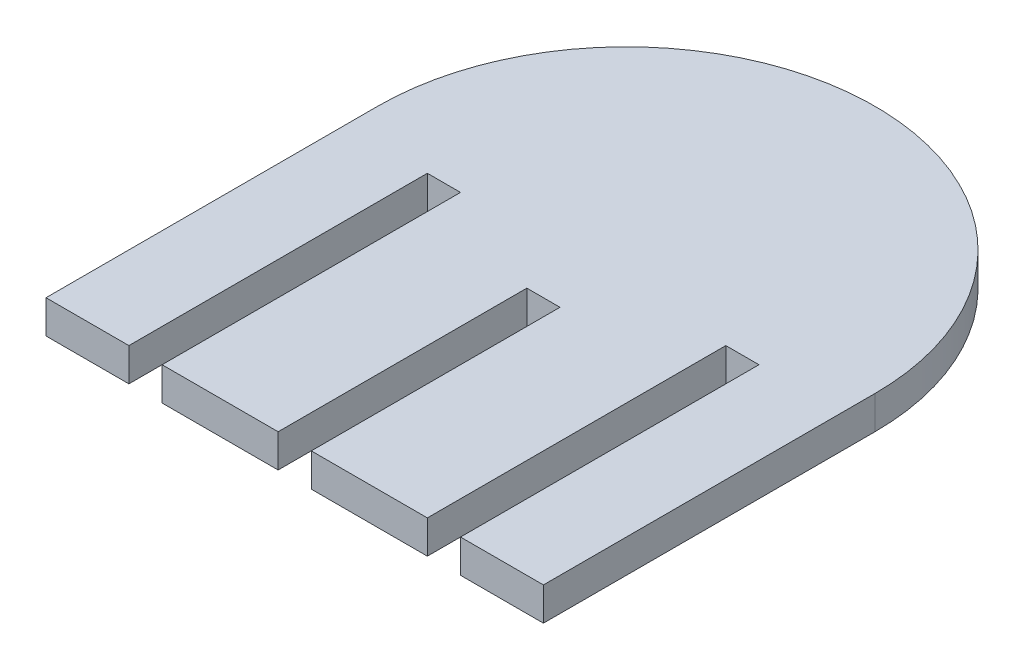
SolidWorks part; units mm, degrees
ref_plane "Front Plane" through (0, 0, 0) normal (0, 0, 1) x (1, 0, 0)
ref_plane "Top Plane" through (0, 0, 0) normal (0, 1, 0) x (1, 0, 0)
ref_plane "Right Plane" through (0, 0, 0) normal (1, 0, 0) x (0, 0, -1)
sketch "Sketch1" plane through (0, 0, 0) normal (0, 1, 0) x (1, 0, 0)
  line L0 (-15, 0) -> (15, 0)
  line L1 (-15, 0) -> (-15, 20)
  line L2 (15, 0) -> (15, 20)
  arc A0 (-15, 20) -> (15, 20) centre (0, 20) cw
  point P4 (0, 0)
  dimension "D2" = 20
  dimension "D1" = 30
extrude "Boss-Extrude1" add sketch "Sketch1" along normal blind 2
sketch "Sketch2" plane through (0, 2, 0) normal (0, 1, 0) x (1, 0, 0)
  line L0 (0, 0) -> (0, 35) construction
  line L1 (-15, 0) -> (15, 0) construction
  arc A0 (15, 20) -> (-15, 20) centre (0, 20) ccw construction
sketch "Sketch3" plane through (0, 0, 0) normal (0, 0, 1) x (1, 0, 0)
  line L0 (8, -193) -> (8, 7) construction
  line L1 (8, 0) -> (10, 0)
  line L2 (8, 0) -> (8, 2)
  line L3 (8, 2) -> (10, 2)
  line L4 (10, 0) -> (10, 2)
  line L5 (-15, 0) -> (15, 0) construction
  line L6 (10, -193) -> (10, 7) construction
  line L7 (-15, 2) -> (15, 2) construction
  line L8 (-8, -201.48) -> (-8, 8.52) construction
  line L9 (-8, 0) -> (-10, 0)
  line L10 (-8, 0) -> (-8, 2)
  line L11 (-8, 2) -> (-10, 2)
  line L12 (-10, 0) -> (-10, 2)
  line L13 (-10, -201.48) -> (-10, 8.52) construction
extrude "Cut-Extrude1" cut sketch "Sketch3" against normal blind 18
sketch "Sketch4" plane through (0, 0, 0) normal (0, 0, 1) x (1, 0, 0)
  line L0 (-8, 0) -> (8, 0) construction
  line L1 (1, 0) -> (-1, 0)
  line L2 (1, 0) -> (1, 2)
  line L3 (1, 2) -> (-1, 2)
  line L4 (-1, 0) -> (-1, 2)
  line L5 (1, -8) -> (1, 7) construction
  line L6 (-8, 2) -> (8, 2) construction
  line L7 (-1, -8) -> (-1, 7) construction
extrude "Cut-Extrude2" cut sketch "Sketch4" against normal blind 15
equation "\"anch\" = 2"
equation "\"alt\" = 100"
equation "\"pilanch\" = 100"
equation "\"pilalt\" = 250"
equation "\"bodyHeigh\" = 60"
equation "\"dorsalFinHeigh\" = 400"
equation "\"D1@Boss-Extrude1\"=\"anch\""
